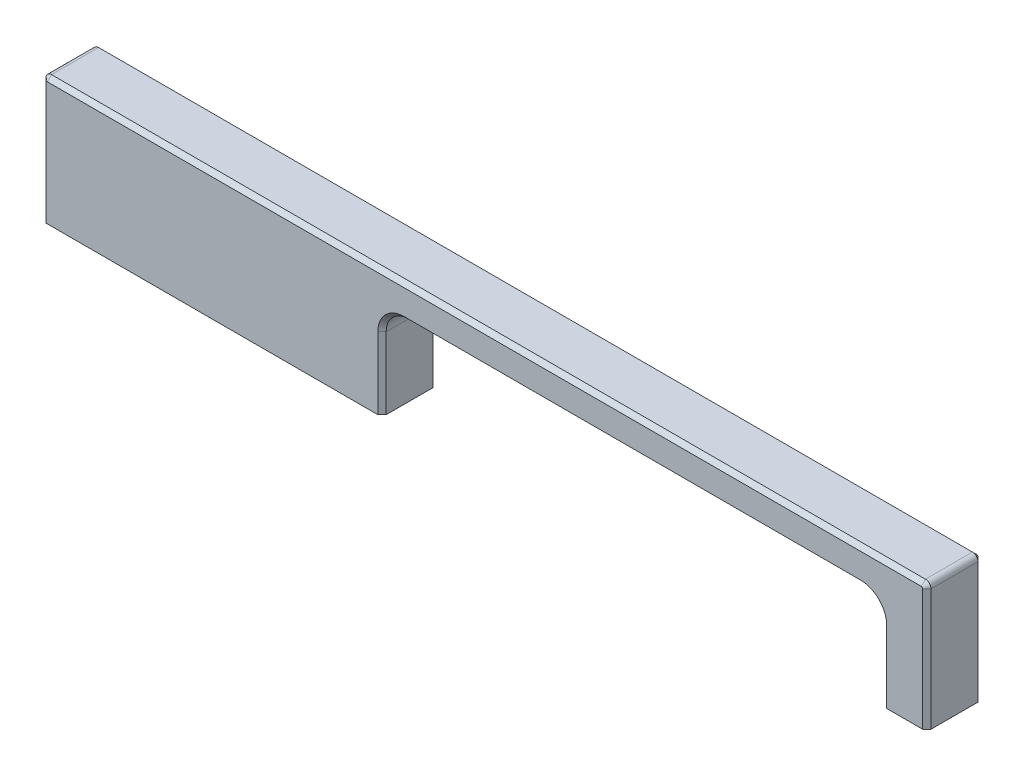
SolidWorks part; units mm, degrees
ref_plane "正面" through (0, 0, 0) normal (0, 0, 1) x (1, 0, 0)
ref_plane "平面" through (0, 0, 0) normal (0, 1, 0) x (1, 0, 0)
ref_plane "右側面" through (0, 0, 0) normal (1, 0, 0) x (0, 0, -1)
sketch "ｽｹｯﾁ1" plane through (0, 0, 0) normal (0, 0, 1) x (1, 0, 0)
  line L0 (80, 0) -> (72, 0)
  line L1 (72, 0) -> (72, 17)
  line L2 (72, 17) -> (-18.5, 17)
  line L3 (-18.5, 17) -> (-18.5, 0)
  line L4 (-18.5, 0) -> (-80, 0)
  line L5 (-80, 0) -> (-80, 23)
  line L6 (-80, 23) -> (80, 23)
  line L7 (80, 23) -> (80, 0)
  line L8 (0, 0) -> (0, 5.2386) construction
  dimension "D1" = 8
  dimension "D2" = 160
  dimension "D3" = 23
  dimension "D4" = 6
  dimension "D5" = 61.5
extrude "ﾎﾞｽ - 押し出し1" add sketch "ｽｹｯﾁ1" along normal mid plane 10
hole_wizard "M4x0.7 ねじ穴1" positions "ｽｹｯﾁ2" profile "ｽｹｯﾁ3" tap size "M4x0.7" standard "Ansi Metric"
sketch "ｽｹｯﾁ2" plane through (0, 0, 0) normal (0, -1, 0) x (-1, 0, 0)
  line L0 (54, 0) -> (-76, 0) construction
  line L2 (-72, -5) -> (-72, 5) construction
  point P0 (-76, 0)
  point P2 (54, 0)
  dimension "D1" = 4
  dimension "D2" = 130
sketch "ｽｹｯﾁ3" plane through (76, 0, 0) normal (1, 0, 0) x (0, 0, -1)
  line L0 (0, 0) -> (0, 12.4914)
  line L1 (0, 12.4914) -> (1.65, 11.5)
  line L2 (1.65, 11.5) -> (1.65, 0)
  line L5 (1.65, 0) -> (0, 0)
  line L10 (0, 12.4914) -> (-1.65, 11.5) construction
  line L11 (0, -6.35) -> (0, 107.95) construction
  dimension "ねじ下穴ﾄﾞﾘﾙ直径" = 3.3
  dimension "ねじ下穴ﾄﾞﾘﾙの深さ" = 11.5
  dimension "ﾄﾞﾘﾙ角度" = 118
fillet "ﾌｨﾚｯﾄ1" radius 4 2 edges at (72, 17, 0) (-18.5, 17, 0)
fillet "ﾌｨﾚｯﾄ2" radius 1 2 edges at (80, 23, 0) (-80, 23, 0)
chamfer "面取り1" distance 0.75 angle 45 20 edges at (72, 6.5, -5) (70.8284, 15.8284, -5) (26.75, 17, -5) (-17.3284, 15.8284, -5) (-18.5, 6.5, -5) (80, 11, -5) (79.7071, 22.7071, -5) (0, 23, -5) (-79.7071, 22.7071, -5) (-80, 11, -5) (72, 6.5, 5) (70.8284, 15.8284, 5) (26.75, 17, 5) (-17.3284, 15.8284, 5) (-18.5, 6.5, 5) (80, 11, 5) (79.7071, 22.7071, 5) (0, 23, 5) (-79.7071, 22.7071, 5) (-80, 11, 5)
